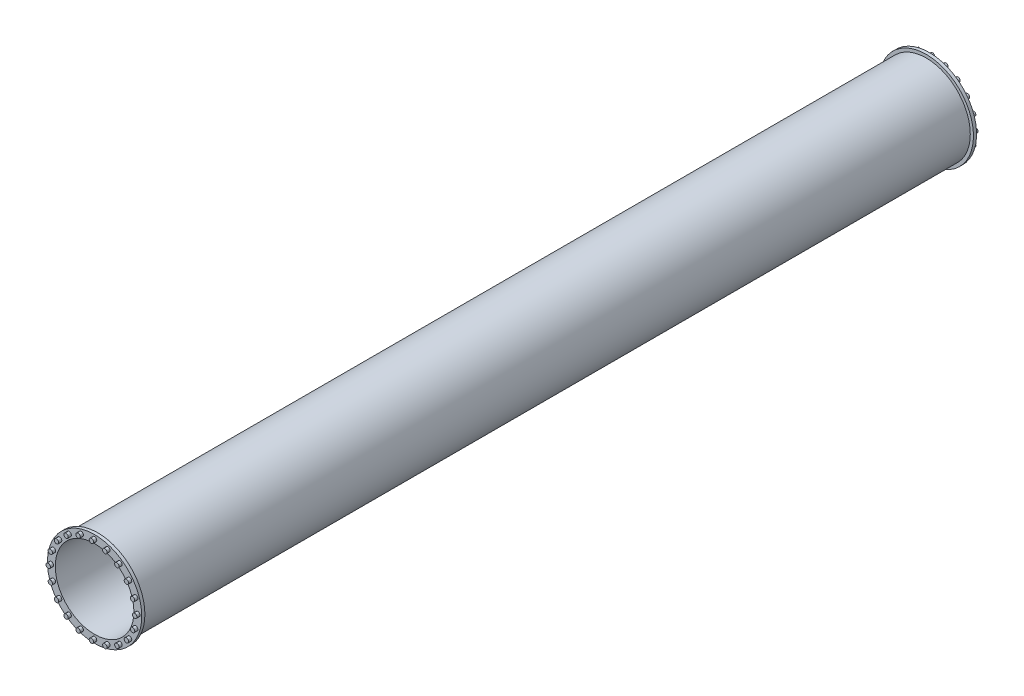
SolidWorks part; units mm, degrees
ref_plane "Front Plane" through (0, 0, 0) normal (0, 0, 1) x (1, 0, 0)
ref_plane "Top Plane" through (0, 0, 0) normal (0, 1, 0) x (1, 0, 0)
ref_plane "Right Plane" through (0, 0, 0) normal (1, 0, 0) x (0, 0, -1)
sketch "Sketch1" plane through (0, 0, 0) normal (0, 0, 1) x (1, 0, 0)
  circle A0 centre (0, 0) radius 125
  circle A1 centre (0, 0) radius 150
  dimension "D1" = 250
  dimension "D2" = 300
extrude "Boss-Extrude1" add sketch "Sketch1" along normal blind 10
sketch "Sketch2" plane through (0, 0, 10) normal (0, 0, 1) x (1, 0, 0)
  circle A1 centre (0, 137.5) radius 7
  dimension "D1" = 137.5
extrude "Boss-Extrude2" add sketch "Sketch2" along normal blind 10
pattern_circular "CirPattern1" count 20 over 360 about axis through (0, 0, 0) along (0, 0, 1) of "Boss-Extrude2"
sketch "Sketch3" plane through (0, 0, 0) normal (0, 0, -1) x (-1, 0, 0)
  circle A0 centre (0, 0) radius 125
  circle A1 centre (0, 0) radius 140
extrude "Boss-Extrude3" add sketch "Sketch3" along normal blind 2635
sketch "Sketch4" plane through (0, 0, -2635) normal (0, 0, -1) x (-1, 0, 0)
  circle A0 centre (0, 0) radius 125
  circle A1 centre (0, 0) radius 150
extrude "Boss-Extrude4" add sketch "Sketch4" along normal blind 10
sketch "Sketch5" plane through (0, 0, -2645) normal (0, 0, -1) x (-1, 0, 0)
  circle A1 centre (0, 137.5) radius 7
  dimension "D1" = 137.5
extrude "Boss-Extrude5" add sketch "Sketch5" along normal blind 10
pattern_circular "CirPattern2" count 20 over 360 about axis through (0, 0, 0) along (0, 0, 1) of "Boss-Extrude5"
